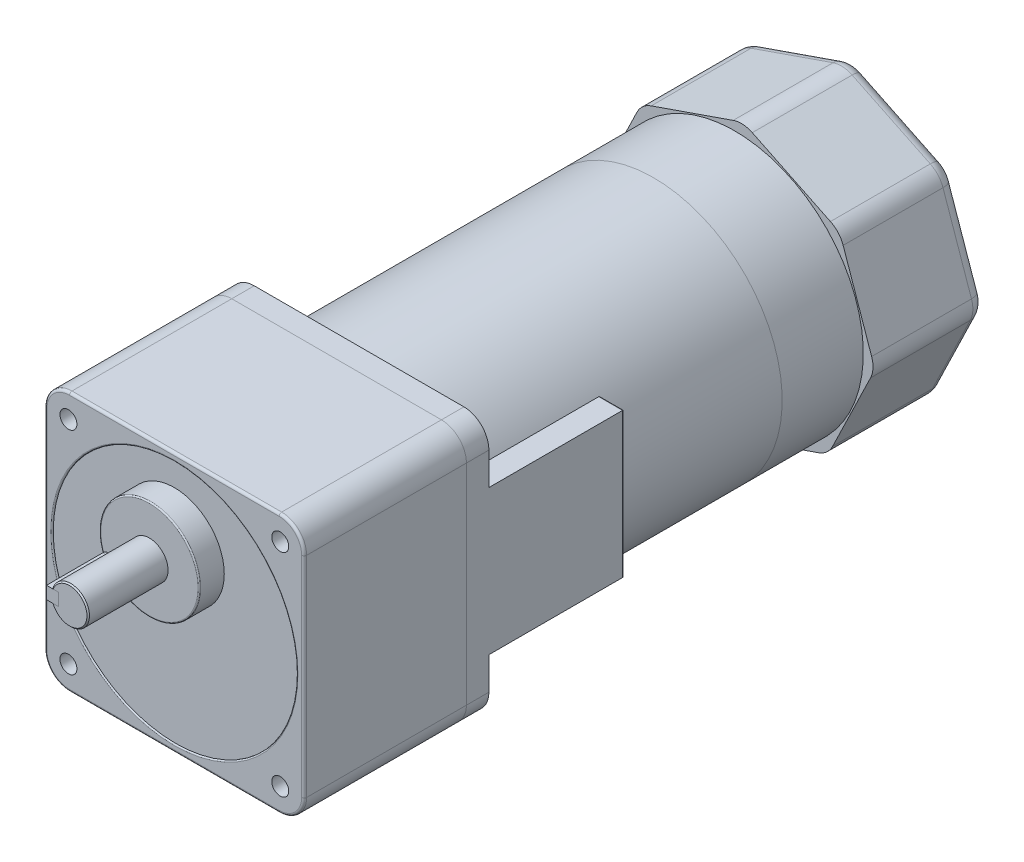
SolidWorks part; units mm, degrees
ref_plane "前视基准面" through (0, 0, 0) normal (0, 0, 1) x (1, 0, 0)
ref_plane "上视基准面" through (0, 0, 0) normal (0, 1, 0) x (1, 0, 0)
ref_plane "右视基准面" through (0, 0, 0) normal (1, 0, 0) x (0, 0, -1)
sketch "草图1" plane through (0, 0, 0) normal (0, 0, 1) x (1, 0, 0)
  line L1 (-42, -52) -> (42, -52)
  line L2 (-52, -42) -> (-52, 42)
  line L3 (-42, 52) -> (42, 52)
  line L4 (52, -42) -> (52, 42)
  line L5 (-52, -52) -> (52, 52) construction
  line L6 (-52, 52) -> (52, -52) construction
  arc A0 (-42, -52) -> (-52, -42) centre (-42, -42) cw
  arc A1 (-52, 42) -> (-42, 52) centre (-42, 42) cw
  arc A2 (42, 52) -> (52, 42) centre (42, 42) cw
  arc A3 (42, -52) -> (52, -42) centre (42, -42) ccw
  point P0 (0, 0)
  dimension "D1" = 10
extrude "凸台-拉伸1" add sketch "草图1" along normal blind 65
sketch "草图2" plane through (0, 0, 0) normal (0, 0, -1) x (-1, 0, 0)
  line L0 (52, 42) -> (52, -42) construction
  line L1 (-42, 52) -> (42, 52)
  line L2 (-52, 42) -> (-52, -42)
  line L3 (-42, -52) -> (42, -52)
  line L4 (52, 42) -> (52, -42)
  line L5 (-52, 52) -> (52, -52) construction
  line L6 (-52, -52) -> (52, 52) construction
  arc A0 (42, -52) -> (52, -42) centre (42, -42) ccw
  arc A1 (-52, -42) -> (-42, -52) centre (-42, -42) ccw
  arc A2 (-42, 52) -> (-52, 42) centre (-42, 42) ccw
  arc A3 (42, 52) -> (52, 42) centre (42, 42) cw
  point P0 (0, 0)
  dimension "D1" = 10
extrude "凸台-拉伸2" add sketch "草图2" along normal blind 9 separate body
sketch "草图3" plane through (0, 0, -9) normal (0, 0, -1) x (-1, 0, 0)
  line L0 (-52, 42) -> (-52, -42) construction
  line L1 (0, 29) -> (-52, 29)
  line L3 (0, -29) -> (-52, -29)
  line L4 (-52, 29) -> (-52, -29)
  line L8 (0, 29) -> (0, -29)
  point P0 (0, 0)
extrude "凸台-拉伸3" add sketch "草图3" along normal blind 54
sketch "草图4" plane through (0, 0, -9) normal (0, 0, -1) x (-1, 0, 0)
  circle A0 centre (0, 0) radius 51.5
extrude "凸台-拉伸4" add sketch "草图4" along normal blind 118 separate body
sketch "草图5" plane through (0, 0, -127) normal (0, 0, -1) x (-1, 0, 0)
  circle A0 centre (0, 0) radius 51.5
extrude "凸台-拉伸5" add sketch "草图5" along normal blind 32.5 separate body
sketch "草图6" plane through (0, 0, -159.5) normal (0, 0, -1) x (-1, 0, 0)
  line L1 (-7.0224, 54.3814) -> (-38.3332, 39.2074)
  line L2 (-43.419, 33.4879) -> (-54.8295, 0.6182)
  line L3 (-54.3814, -7.0224) -> (-39.2074, -38.3332)
  line L4 (-33.4879, -43.419) -> (-0.6182, -54.8295)
  line L5 (7.0224, -54.3814) -> (38.3332, -39.2074)
  line L6 (43.419, -33.4879) -> (54.8295, -0.6182)
  line L7 (54.3814, 7.0224) -> (39.2074, 38.3332)
  line L8 (33.4879, 43.419) -> (0.6182, 54.8295)
  circle A0 centre (0, 0) radius 52 construction
  arc A1 (-54.8295, 0.6182) -> (-54.3814, -7.0224) centre (-45.3825, -2.6612) ccw
  arc A2 (-39.2074, -38.3332) -> (-33.4879, -43.419) centre (-30.2085, -33.9721) ccw
  arc A3 (-0.6182, -54.8295) -> (7.0224, -54.3814) centre (2.6612, -45.3825) ccw
  arc A4 (38.3332, -39.2074) -> (43.419, -33.4879) centre (33.9721, -30.2085) ccw
  arc A5 (54.8295, -0.6182) -> (54.3814, 7.0224) centre (45.3825, 2.6612) ccw
  arc A6 (39.2074, 38.3332) -> (33.4879, 43.419) centre (30.2085, 33.9721) ccw
  arc A7 (-7.0224, 54.3814) -> (0.6182, 54.8295) centre (-2.6612, 45.3825) cw
  arc A8 (-38.3332, 39.2074) -> (-43.419, 33.4879) centre (-33.9721, 30.2085) ccw
  dimension "D1" = 10
extrude "凸台-拉伸6" add sketch "草图6" along normal blind 45 separate body
fillet "圆角1" radius 5 16 edges at (49.1243, 17.0531, -204.5) (41.4449, 36.8535, -204.5) (22.6778, 46.7944, -204.5) (3.2466, 55.3654, -204.5) (-17.0531, 49.1243, -204.5) (-36.8535, 41.4449, -204.5) (-46.7944, 22.6778, -204.5) (-55.3654, 3.2466, -204.5) (-49.1243, -17.0531, -204.5) (-41.4449, -36.8535, -204.5) (-22.6778, -46.7944, -204.5) (-3.2466, -55.3654, -204.5) (17.0531, -49.1243, -204.5) (36.8535, -41.4449, -204.5) (46.7944, -22.6778, -204.5) (55.3654, -3.2466, -204.5)
fillet "圆角2" radius 1 8 edges at (-52, 0, 65) (-49.0711, 49.0711, 65) (0, 52, 65) (49.0711, 49.0711, 65) (52, 0, 65) (49.0711, -49.0711, 65) (0, -52, 65) (-49.0711, -49.0711, 65)
fillet "圆角3" radius 0.5 3 edges at (26, -29, -63) (26, 29, -63) (52, 0, -63)
sketch "草图7" plane through (0, 0, 65) normal (0, 0, 1) x (1, 0, 0)
  point P19 (-42.4264, 42.4264)
  point P20 (-42.4264, -42.4264)
  point P21 (42.4264, -42.4264)
  point P22 (42.4264, 42.4264)
sketch "草图9" plane through (0, 0, -9) normal (0, 0, -1) x (-1, 0, 0)
  circle A5 centre (-42.4264, -42.4264) radius 4.5
  circle A6 centre (42.4264, -42.4264) radius 4.5
  circle A7 centre (-42.4264, 42.4264) radius 4.5
  circle A8 centre (42.4264, 42.4264) radius 4.5
extrude "切除-拉伸1" cut sketch "草图9" against normal blind 51.75
hole_wizard "M8 螺纹孔2" positions "3D草图4" profile "草图11" tap size "M8" standard "GB"
sketch3d "3D草图4"
  point P0 (-42.4264, 42.4264, 65)
  point P3 (42.4264, 42.4264, 65)
  point P6 (42.4264, -42.4264, 65)
  point P9 (-42.4264, -42.4264, 65)
sketch "草图11" plane through (-42.4264, 42.4264, 65) normal (1, 0, 0) x (0, -1, 0)
  line L0 (0, 0) -> (0, 24.2929)
  line L1 (0, 24.2929) -> (3.4, 22.25)
  line L2 (3.4, 22.25) -> (3.4, 0)
  line L5 (3.4, 0) -> (0, 0)
  line L10 (0, 24.2929) -> (-3.4, 22.25) construction
  line L11 (0, -6.35) -> (0, 107.95) construction
  dimension "螺纹孔钻头直径" = 6.8
  dimension "螺纹孔钻头深度" = 22.25
  dimension "导头角度" = 118
sketch "草图12" plane through (0, 0, 65) normal (0, 0, 1) x (1, 0, 0)
  circle A0 centre (0, 20) radius 20
extrude "凸台-拉伸7" add sketch "草图12" along normal blind 10 separate body
fillet "圆角4" radius 0.5 1 edges at (20, 20, 75)
sketch "草图13" plane through (0, 0, 75) normal (0, 0, 1) x (1, 0, 0)
  circle A0 centre (0, 20) radius 7.5
extrude "凸台-拉伸8" add sketch "草图13" along normal blind 32 separate body
ref_plane "基准面1" through (-7.5, 0, 0) normal (1, 0, 0) x (0, 0, -1)
chamfer "倒角2" distance 0.5 angle 45 1 edges at (7.5, 20, 107)
sketch "草图16" plane through (0, 0, 65) normal (0, 0, 1) x (1, 0, 0)
  circle A0 centre (0, 0) radius 49
extrude "切除-拉伸3" cut sketch "草图16" against normal blind 0.5
fillet "圆角5" radius 0.5 1 edges at (49, 0, 65)
sketch "草图19" plane through (-7.5, 0, 0) normal (1, 0, 0) x (0, 0, -1)
  line L1 (-107, 27) -> (-107, 13) construction
  line L2 (-84.5, 22.5) -> (-107, 22.5)
  line L3 (-107, 22.5) -> (-107, 17.5)
  line L4 (-107, 17.5) -> (-84.5, 17.5)
  arc A0 (-84.5, 17.5) -> (-84.5, 22.5) centre (-84.5, 20) ccw
extrude "切除-拉伸4" cut sketch "草图19" along normal blind 3
sketch "草图20" plane through (-4.5, 0, 0) normal (-1, 0, 0) x (0, 0, 1)
  line L0 (84.5, 22.5) -> (107, 22.5)
  line L1 (107, 22.5) -> (107, 17.5)
  line L2 (107, 17.5) -> (84.5, 17.5)
  arc A0 (84.5, 22.5) -> (84.5, 17.5) centre (84.5, 20) ccw
extrude "凸台-拉伸9" add sketch "草图20" along normal blind 5 separate body
chamfer "倒角3" distance 0.3 angle 45 4 edges at (-9.5, 22.5, 95.75) (-9.5, 20, 107) (-9.5, 17.5, 95.75) (-9.5, 20, 82)
